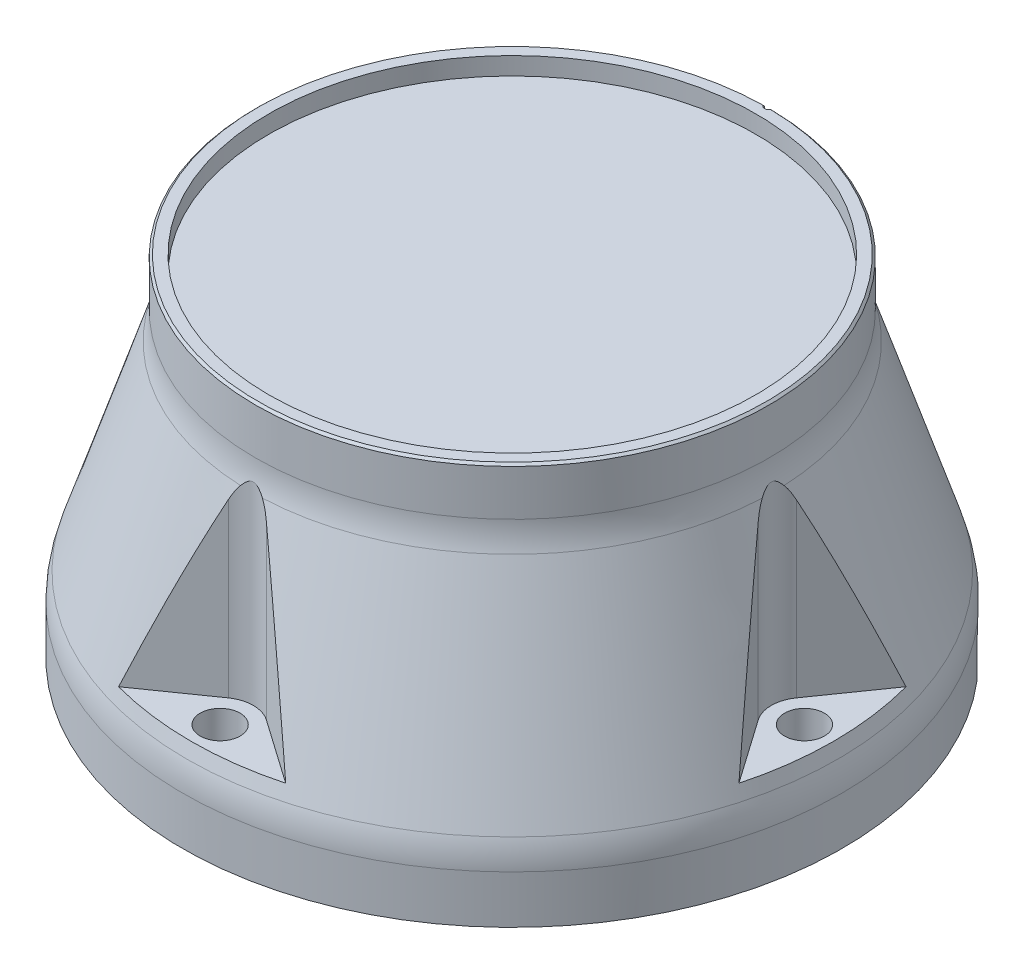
SolidWorks part; units mm, degrees
ref_plane "前视基准面" through (0, 0, 0) normal (0, 0, 1) x (1, 0, 0)
ref_plane "上视基准面" through (0, 0, 0) normal (0, 1, 0) x (1, 0, 0)
ref_plane "右视基准面" through (0, 0, 0) normal (1, 0, 0) x (0, 0, -1)
imported_body "8.0.00.8011790-1-solid1"
other "删除面1"
sketch "草图1" plane through (0, 45, 0) normal (0, -1, 0) x (1, 0, 0)
  circle A1 centre (0, 0) radius 55.25
  circle A2 centre (0, 0) radius 55.25
  dimension "D1" = 0
extrude "凸台-拉伸1" add sketch "草图1" against normal up to surface (30 mm away)
